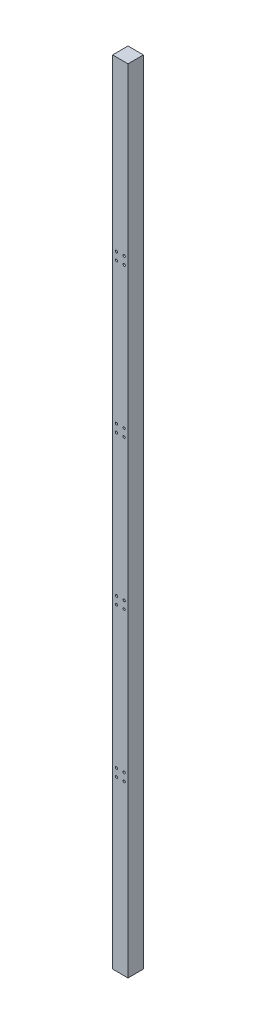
SolidWorks part; units mm, degrees
ref_plane "前视基准面" through (0, 0, 0) normal (0, 0, 1) x (1, 0, 0)
ref_plane "上视基准面" through (0, 0, 0) normal (0, 1, 0) x (1, 0, 0)
ref_plane "右视基准面" through (0, 0, 0) normal (1, 0, 0) x (0, 0, -1)
other "Configuration Table"
sketch "草图1" plane through (0, 0, 0) normal (0, 1, 0) x (1, 0, 0)
  line L1 (-30, 30) -> (30, 30)
  line L2 (-30, 30) -> (-30, -30)
  line L3 (-30, -30) -> (30, -30)
  line L4 (30, 30) -> (30, -30)
  line L5 (-30, 30) -> (30, -30) construction
  line L6 (-30, -30) -> (30, 30) construction
  point P0 (0, 0)
extrude "凸台-拉伸1" add sketch "草图1" along normal blind 3080
sketch "草图2" plane through (-30, 0, 0) normal (-1, 0, 0) x (0, 0, 1)
  line L0 (-30, 670) -> (30, 670)
  line L1 (-30, 3080) -> (-30, 0) construction
  line L2 (30, 3080) -> (30, 0) construction
  line L3 (-30, 1250) -> (30, 1250)
  line L4 (-30, 1830) -> (30, 1830)
  line L5 (-30, 1250) -> (30, 1250)
  line L6 (-30, 0) -> (30, 0) construction
  line L7 (-30, 2410) -> (30, 2410)
  line L9 (-30, 3080) -> (30, 3080) construction
  dimension "D1" = 670
  dimension "D2" = 580
  dimension "D3" = 580
  dimension "D4" = 580
  dimension "D5" = 670
sketch "草图3" plane through (0, 0, -30) normal (0, 0, -1) x (-1, 0, 0)
  line L0 (30, 3080) -> (30, 0) construction
  line L1 (-30, 0) -> (30, 0) construction
  point P0 (15, 655)
  point P5 (15, 1235)
  point P6 (15, 1815)
  point P7 (15, 2395)
  point P8 (-15, 655)
  point P9 (-15, 685)
  point P10 (15, 685)
  point P11 (15, 2395)
  point P12 (-15, 1235)
  point P13 (-15, 1265)
  point P14 (15, 1265)
  point P15 (-15, 1815)
  point P16 (-15, 1845)
  point P17 (15, 1845)
  point P18 (15, 1815)
  point P20 (-15, 2395)
  point P21 (-15, 2425)
  point P23 (15, 2425)
  dimension "D1" = 15
  dimension "D2" = 655
  dimension "D5" = 580
  dimension "D8" = 580
  dimension "D9" = 2
  dimension "D11" = 580
  dimension "D10" = 2
  dimension "D3" = 2
  dimension "D4" = 2
  dimension "D6" = 2
  dimension "D7" = 2
hole_wizard "M8 内六角花型圆柱头螺钉的柱形沉头孔1" positions "草图4" profile "草图5" counterbore size "M8" standard "GB"
sketch "草图4" plane through (0, 0, -30) normal (0, 0, -1) x (-1, 0, 0)
  point P0 (15, 655)
  point P3 (-15, 655)
  point P6 (-15, 685)
  point P9 (15, 685)
  point P12 (15, 1235)
  point P15 (-15, 1235)
  point P18 (-15, 1265)
  point P21 (15, 1265)
  point P24 (15, 1815)
  point P27 (-15, 1815)
  point P30 (-15, 1845)
  point P33 (15, 1845)
  point P36 (15, 2395)
  point P39 (-15, 2395)
  point P42 (-15, 2425)
  point P45 (15, 2425)
sketch "草图5" plane through (-15, 655, -30) normal (1, 0, 0) x (0, 1, 0)
  line L0 (0, 0) -> (0, 60)
  line L1 (0, 60) -> (4.5, 60)
  line L3 (4.5, 60) -> (4.5, 6)
  line L4 (4.5, 6) -> (7.5, 6)
  line L5 (7.5, 6) -> (7.5, 0)
  line L7 (7.5, 0) -> (0, 0)
  line L11 (0, -6.35) -> (0, 107.95) construction
  dimension "通孔孔直径" = 9
  dimension "通孔孔深度" = 60
  dimension "柱形沉头孔直径" = 15
  dimension "柱形沉头孔深度" = 6
